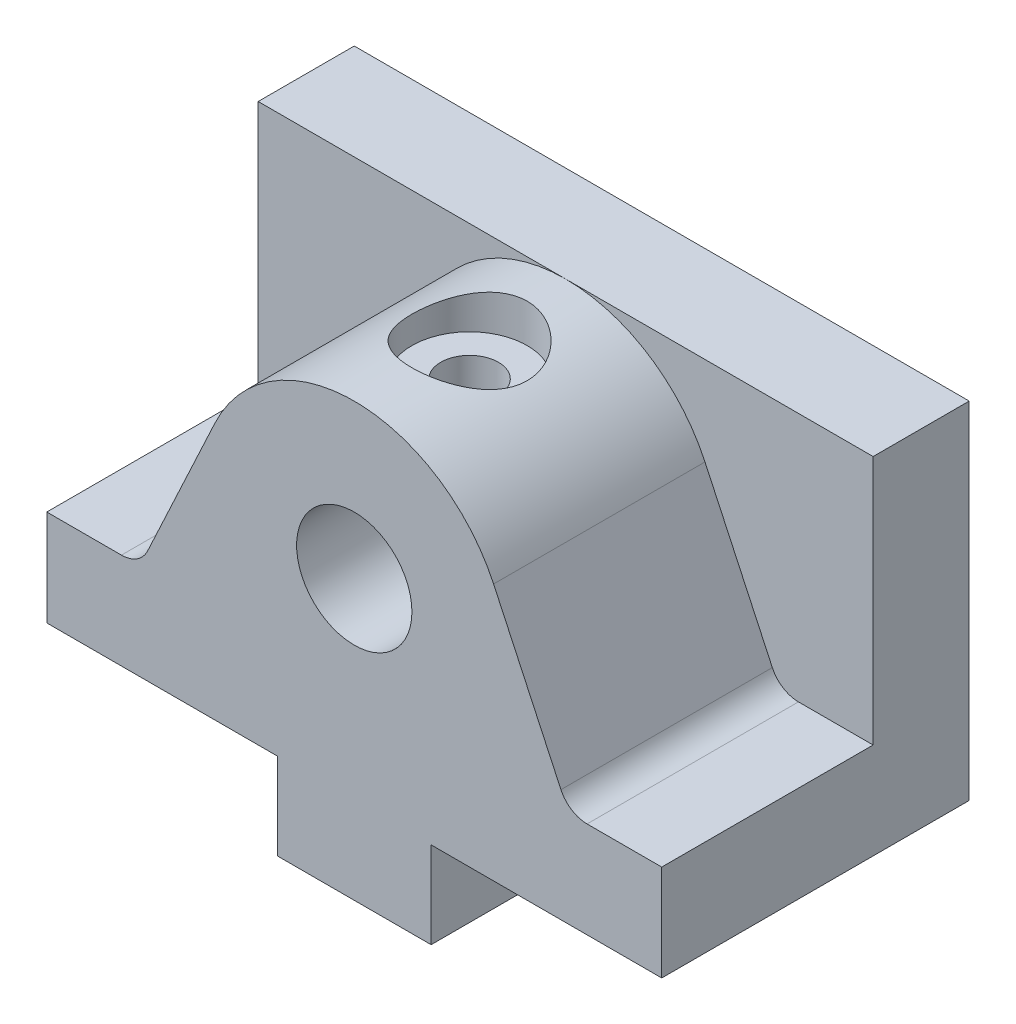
SolidWorks part; units mm, degrees
ref_plane "Front Plane" through (0, 0, 0) normal (0, 0, 1) x (1, 0, 0)
ref_plane "Top Plane" through (0, 0, 0) normal (0, 1, 0) x (1, 0, 0)
ref_plane "Right Plane" through (0, 0, 0) normal (1, 0, 0) x (0, 0, -1)
sketch "Sketch1" plane through (0, 0, 0) normal (0, 0, 1) x (1, 0, 0)
  line L0 (0, 0) -> (0, 40.9271) construction
  line L1 (-32, 0) -> (-8, 0)
  line L2 (-8, 0) -> (-8, -9)
  line L3 (-8, -9) -> (8, -9)
  line L4 (8, -9) -> (8, 0)
  line L5 (8, 0) -> (32, 0)
  line L6 (32, 0) -> (32, 10)
  line L7 (32, 10) -> (22.3171, 10)
  line L8 (22.3171, 10) -> (14.5009, 26.7619)
  line L9 (-14.5009, 26.7619) -> (-22.3171, 10)
  line L10 (-22.3171, 10) -> (-32, 10)
  line L11 (-32, 10) -> (-32, 0)
  arc A0 (14.5009, 26.7619) -> (-14.5009, 26.7619) centre (0, 20) ccw
  dimension "D7" = 16
  dimension "D1" = 16
  dimension "D2" = 64
  dimension "D3" = 10
  dimension "D4" = 9
  dimension "D5" = 36
  dimension "D6" = 50
extrude "Boss-Extrude1" add sketch "Sketch1" along normal blind 22
sketch "Sketch2" plane through (0, 0, 0) normal (0, 0, -1) x (-1, 0, 0)
  line L0 (-32, 0) -> (-32, 10) construction
  line L1 (-8, 0) -> (-32, 0) construction
  line L2 (-8, -9) -> (-8, 0) construction
  line L3 (8, -9) -> (-8, -9) construction
  line L4 (8, 0) -> (8, -9) construction
  line L5 (32, 0) -> (8, 0) construction
  line L6 (32, 10) -> (32, 0) construction
  line L7 (-32, 0) -> (-32, 10)
  line L8 (-8, 0) -> (-32, 0)
  line L9 (-8, -9) -> (-8, 0)
  line L10 (8, -9) -> (-8, -9)
  line L11 (8, 0) -> (8, -9)
  line L12 (32, 0) -> (8, 0)
  line L13 (32, 10) -> (32, 0)
  line L14 (-32, 36) -> (32, 36)
  line L15 (-32, 36) -> (-32, 10)
  line L17 (32, 36) -> (32, 10)
  arc A0 (14.5009, 26.7619) -> (-14.5009, 26.7619) centre (0, 20) ccw construction
extrude "Boss-Extrude2" add sketch "Sketch2" along normal blind 10
fillet "Fillet1" radius 3 2 edges at (-22.3171, 10, 11) (22.3171, 10, 11)
sketch "Sketch3" plane through (0, 0, 22) normal (0, 0, 1) x (1, 0, 0)
  circle A0 centre (0, 20) radius 6
  arc A1 (14.5009, 26.7619) -> (-14.5009, 26.7619) centre (0, 20) ccw construction
  dimension "D1" = 12
extrude "Cut-Extrude1" cut sketch "Sketch3" against normal blind 24
hole_wizard "M6x1.0 Tapped Hole1" positions "Sketch5" profile "Sketch4" tap size "M6x1.0" standard "ANSI Metric"
sketch "Sketch5" plane through (0, -9, 0) normal (0, -1, 0) x (1, 0, 0)
  line L0 (-8, 22) -> (8, 22) construction
  point P0 (0, 14)
  point P1 (0, -2)
  dimension "D1" = 8
  dimension "D2" = 16
sketch "Sketch4" plane through (0, -9, 14) normal (1, 0, 0) x (0, 0, -1)
  line L0 (0, 0) -> (0, 18.8026)
  line L1 (0, 18.8026) -> (3, 17)
  line L2 (3, 17) -> (3, 0)
  line L5 (3, 0) -> (0, 0)
  line L10 (0, 18.8026) -> (-3, 17) construction
  line L11 (0, -6.35) -> (0, 107.95) construction
  dimension "Tap Drill Dia." = 6
  dimension "Tap Drill Depth" = 17
  dimension "Drill Angle" = 118
hole_wizard "Hole1" positions "Sketch12" profile "Sketch11" legacy
sketch "Sketch12" plane through (0, 36, 0) normal (0, 1, 0) x (-1, 0, 0)
  line L0 (32, -10) -> (-32, -10) construction
  point P0 (0, 10)
  dimension "D1" = 20
sketch "Sketch11" plane through (0, 36, 10) normal (1, 0, 0) x (0, 0, 1)
  line L0 (0, 0) -> (0, 17.8016)
  line L1 (0, 17.8016) -> (3, 15.999)
  line L2 (3, 15.999) -> (3, 4)
  line L3 (3, 4) -> (6, 4)
  line L4 (6, 0) -> (0, 0)
  line L5 (0, -11.3109) -> (0, 121.1557) construction
  line L6 (0, 17.8016) -> (-3, 15.999) construction
  line L7 (6, 4) -> (6, 0)
  dimension "Depth" = 15.999
  dimension "Drill Angle" = 118
  dimension "Diameter" = 6
  dimension "C-Bore Diameter" = 12
  dimension "C-Bore Depth" = 4
